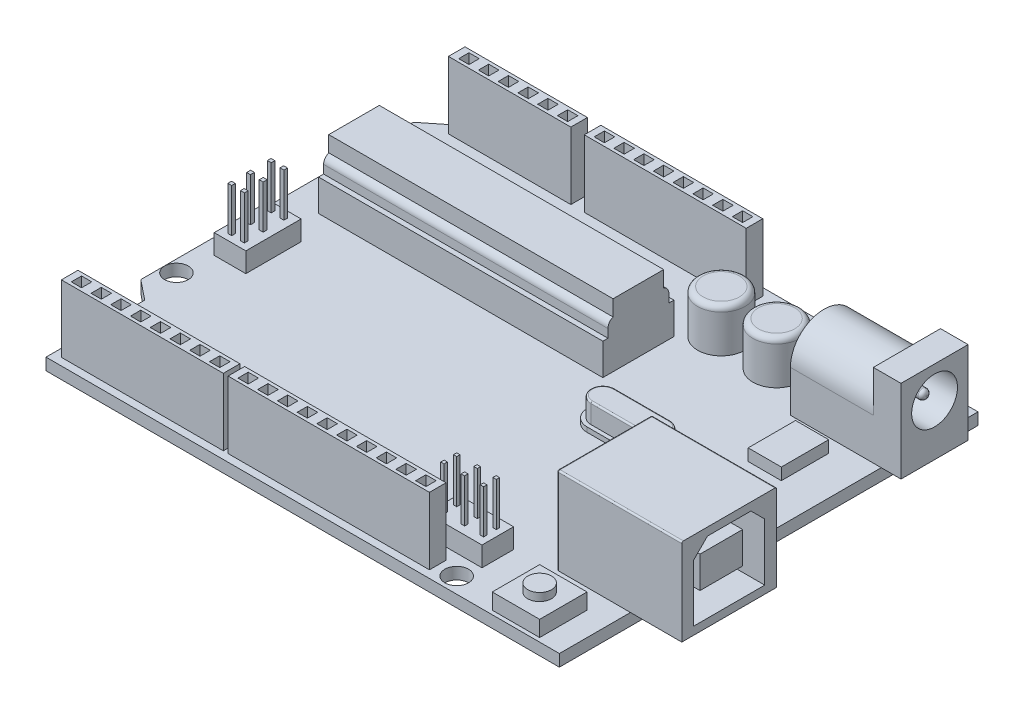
SolidWorks part; units mm, degrees
ref_plane "Alzado" through (0, 0, 0) normal (0, 0, 1) x (1, 0, 0)
ref_plane "Planta" through (0, 0, 0) normal (0, 1, 0) x (1, 0, 0)
ref_plane "Vista lateral" through (0, 0, 0) normal (1, 0, 0) x (0, 0, -1)
sketch "Croquis1" plane through (0, 0, 0) normal (0, 1, 0) x (1, 0, 0)
  line L0 (-32.5, -26.5) -> (-32.5, -14)
  line L1 (-32.5, 26.5) -> (32.5, 26.5)
  line L2 (-32.5, 26.5) -> (-32.5, -26.5) construction
  line L3 (-32.5, -26.5) -> (32.5, -26.5)
  line L4 (32.5, 26.5) -> (32.5, -26.5)
  line L5 (-32.5, 26.5) -> (32.5, -26.5) construction
  line L6 (-32.5, -26.5) -> (32.5, 26.5) construction
  line L7 (-32.5, 26.5) -> (-32.5, 24.5)
  line L8 (-32.5, 24.5) -> (-35, 22.5)
  line L9 (-35, 22.5) -> (-35, -12)
  line L10 (-35, -12) -> (-32.5, -14)
  point P0 (0, 0)
  dimension "D1" = 53
  dimension "D2" = 65
  dimension "D3" = 12.5
  dimension "D4" = 2
  dimension "D5" = 2.5
  dimension "D6" = 2
  dimension "D7" = 2
extrude "Saliente-Extruir1" add sketch "Croquis1" along normal blind 1.5
sketch "Croquis2" plane through (0, 1.5, 0) normal (0, 1, 0) x (1, 0, 0)
  line L0 (-35, 19) -> (34.4446, 19) construction
  line L1 (-35, 22.5) -> (-35, -12) construction
  line L2 (-37.4466, -9) -> (38.9629, -9) construction
  line L3 (-32.5, -26.5) -> (32.5, -26.5) construction
  line L4 (17.5, -22.2903) -> (17.5, -28.2143) construction
  line L5 (32.5, 26.5) -> (-32.5, 26.5) construction
  line L6 (-33.485, -11.6472) -> (-33.485, 23.7964) construction
  line L7 (-36.1413, -24.5) -> (34.4446, -24.5) construction
  line L8 (35.3482, 24.5) -> (-37.4466, 24.5) construction
  line L9 (32.5, -26.5) -> (32.5, 26.5) construction
  line L10 (18.5, 27.8126) -> (18.5, 22.4911) construction
  circle A0 centre (-33.485, 19) radius 1.5
  circle A1 centre (-33.485, -9) radius 1.5
  circle A2 centre (18.5, 24.5) radius 1.5
  circle A3 centre (17.5, -24.5) radius 1.5
  dimension "D4" = 3
  dimension "D5" = 3
  dimension "D10" = 3
  dimension "D11" = 3
  dimension "D1" = 17.5
  dimension "D2" = 7.5
  dimension "D3" = 1.515
  dimension "D6" = 2
  dimension "D7" = 2
  dimension "D8" = 15
  dimension "D9" = 14
extrude "Cortar-Extruir1" cut sketch "Croquis2" against normal through all
sketch "Croquis3" plane through (0, 0, 0) normal (0, -1, 0) x (1, 0, 0)
  line L0 (36.9547, -17.5) -> (-44.9771, -17.5) construction
  line L2 (32.5, -26.5) -> (-32.5, -26.5) construction
  line L3 (27, 28.4151) -> (27, -28.2143) construction
  line L4 (32.5, 26.5) -> (32.5, -26.5) construction
  line L5 (21, 23.2943) -> (21, -22.4911) construction
  line L6 (24.0023, -15.2618) -> (24.0023, -31.2265) construction
  line L7 (19.3836, -23.5) -> (29.123, -23.5) construction
  ellipse E0 centre (27, -17.5) end of major axis (27, -16.5) minor radius 0.15
  ellipse E1 centre (21, -17.5) end of major axis (21, -16.5) minor radius 0.15
  ellipse E2 centre (24.0023, -23.5) end of major axis (25.0023, -23.5) minor radius 0.15
  dimension "D1" = 9
  dimension "D2" = 5.5
  dimension "D3" = 6
  dimension "D4" = 3
  dimension "D5" = 0.3
  dimension "D6" = 2
  dimension "D7" = 0.3
  dimension "D8" = 2
  dimension "D9" = 0.3
  dimension "D10" = 2
extrude "Saliente-Extruir2" add sketch "Croquis3" along normal blind 2.8
fillet "Redondeo1" radius 1 1 edges at (27, 0, -16.5)
fillet "Redondeo2" radius 1 2 edges at (25.0023, 0, -23.5) (21, 0, -16.5)
fillet "Redondeo3" radius 0.1 3 edges at (21, -2.8, -16.5) (25.0023, -2.8, -23.5) (27, -2.8, -16.5)
sketch "Croquis4" plane through (0, 1.5, 0) normal (0, 1, 0) x (1, 0, 0)
  line L0 (32.5, -26.5) -> (32.5, 26.5) construction
  line L1 (23.5, -20) -> (29.5, -20)
  line L2 (23.5, -20) -> (23.5, -26)
  line L3 (23.5, -26) -> (29.5, -26)
  line L4 (29.5, -20) -> (29.5, -26)
  line L5 (23.5, -20) -> (29.5, -26) construction
  line L6 (23.5, -26) -> (29.5, -20) construction
  line L7 (-32.5, -26.5) -> (32.5, -26.5) construction
  point P0 (26.5, -23)
  dimension "D1" = 6
  dimension "D2" = 6
  dimension "D3" = 3
  dimension "D4" = 0.5
extrude "Saliente-Extruir3" add sketch "Croquis4" along normal blind 2
sketch "Croquis5" plane through (0, 3.5, 0) normal (0, 1, 0) x (1, 0, 0)
  circle A0 centre (26.5, -23) radius 1.5
  dimension "D1" = 3
extrude "Saliente-Extruir4" add sketch "Croquis5" along normal blind 1
sketch "Croquis6" plane through (0, 1.5, 0) normal (0, 1, 0) x (1, 0, 0)
  line L0 (10, 1.5) -> (17, 1.5) construction
  line L1 (10, 3.5) -> (17, 3.5)
  line L2 (10, -0.5) -> (17, -0.5)
  line L3 (8, 1.5) -> (8, 12.5737) construction
  line L4 (19, 1.5) -> (19, 12.5737) construction
  line L5 (32.5, 26.5) -> (-32.5, 26.5) construction
  line L7 (32.5, -26.5) -> (32.5, 26.5) construction
  arc A0 (10, 3.5) -> (10, -0.5) centre (10, 1.5) ccw
  arc A1 (17, -0.5) -> (17, 3.5) centre (17, 1.5) ccw
  point P2 (13.5, 1.5)
  dimension "D2" = 11
  dimension "D1" = 7
  dimension "D3" = 25
  dimension "D4" = 19
extrude "Saliente-Extruir5" add sketch "Croquis6" along normal blind 0.6
sketch "Croquis7" plane through (0, 2.1, 0) normal (0, 1, 0) x (1, 0, 0)
  line L0 (10, 1.5) -> (17, 1.5) construction
  line L1 (10, 3) -> (17, 3)
  line L2 (10, 0) -> (17, 0)
  arc A0 (10, 3) -> (10, 0) centre (10, 1.5) ccw
  arc A1 (17, 0) -> (17, 3) centre (17, 1.5) ccw
  point P4 (13.5, 1.5)
extrude "Saliente-Extruir6" add sketch "Croquis7" along normal blind 2.5
fillet "Redondeo4" radius 0.2 4 edges at (13.5, 4.6, -3) (18.5, 4.6, -1.5) (13.5, 4.6, 0) (8.5, 4.6, -1.5)
sketch "Croquis8" plane through (0, 1.5, 0) normal (0, 1, 0) x (1, 0, 0)
  line L0 (32.5, -26.5) -> (32.5, 26.5) construction
  line L1 (23.2, -5.5) -> (39, -5.5)
  line L2 (23.2, -5.5) -> (23.2, -17.5)
  line L3 (23.2, -17.5) -> (39, -17.5)
  line L4 (39, -5.5) -> (39, -17.5)
  line L5 (23.2, -5.5) -> (39, -17.5) construction
  line L6 (23.2, -17.5) -> (39, -5.5) construction
  line L7 (-32.5, -26.5) -> (32.5, -26.5) construction
  point P0 (31.1, -11.5)
  dimension "D1" = 6.5
  dimension "D2" = 15.8
  dimension "D3" = 12
  dimension "D4" = 9
extrude "Saliente-Extruir7" add sketch "Croquis8" along normal blind 11
fillet "Redondeo5" radius 0.2 5 edges at (23.2, 7, 5.5) (23.2, 7, 17.5) (23.2, 12.5, 11.5) (31.1, 12.5, 5.5) (31.1, 12.5, 17.5)
sketch "Croquis9" plane through (0, 1.5, 0) normal (0, 1, 0) x (1, 0, 0)
  line L0 (32.5, 26.5) -> (-32.5, 26.5) construction
  line L1 (21, 22.75) -> (35, 22.75)
  line L2 (21, 22.75) -> (21, 14.25)
  line L3 (21, 14.25) -> (35, 14.25)
  line L4 (35, 22.75) -> (35, 14.25)
  line L5 (21, 22.75) -> (35, 14.25) construction
  line L6 (21, 14.25) -> (35, 22.75) construction
  line L7 (32.5, -5.5) -> (32.5, 26.5) construction
  point P0 (28, 18.5)
  dimension "D1" = 8
  dimension "D2" = 14
  dimension "D3" = 2.5
  dimension "D4" = 8.5
extrude "Saliente-Extruir8" add sketch "Croquis9" along normal blind 10.5
sketch "Croquis10" plane through (21, 0, 0) normal (-1, 0, 0) x (0, 0, 1)
  line L0 (-22.75, 6.75) -> (-14.25, 6.75) construction
  line L1 (-22.75, 12) -> (-22.75, 1.5) construction
  line L2 (-14.25, 12) -> (-14.25, 1.5) construction
  line L3 (-22.75, 6.75) -> (-24.8341, 6.75)
  line L4 (-24.8341, 6.75) -> (-24.8341, 13.7085)
  line L5 (-24.8341, 13.7085) -> (-12.9417, 13.7085)
  line L6 (-12.9417, 13.7085) -> (-12.9417, 6.75)
  line L7 (-12.9417, 6.75) -> (-14.25, 6.75)
  arc A0 (-22.75, 6.75) -> (-14.25, 6.75) centre (-18.5, 6.75) cw
extrude "Cortar-Extruir2" cut sketch "Croquis10" against normal blind 10.5
sketch "Croquis11" plane through (0, 1.5, 0) normal (0, 1, 0) x (1, 0, 0)
  line L0 (-35, 22.5) -> (-35, -12) construction
  line L1 (-31, 15.5) -> (5, 15.5)
  line L2 (-31, 15.5) -> (-31, 6.5)
  line L3 (-31, 6.5) -> (5, 6.5)
  line L4 (5, 15.5) -> (5, 6.5)
  line L5 (-31, 15.5) -> (5, 6.5) construction
  line L6 (-31, 6.5) -> (5, 15.5) construction
  line L7 (32.5, 26.5) -> (-32.5, 26.5) construction
  point P0 (-13, 11)
  dimension "D1" = 36
  dimension "D2" = 9
  dimension "D3" = 4
  dimension "D4" = 11
extrude "Saliente-Extruir9" add sketch "Croquis11" along normal blind 4
sketch "Croquis12" plane through (0, 5.5, 0) normal (0, 1, 0) x (1, 0, 0)
  line L0 (-31, 11) -> (5, 11) construction
  line L1 (-31, 15.5) -> (-31, 6.5) construction
  line L2 (5, 6.5) -> (5, 15.5) construction
  line L4 (-31, 14.8545) -> (5, 14.8545)
  line L5 (-31, 14.8545) -> (-31, 7.1455)
  line L6 (-31, 7.1455) -> (5, 7.1455)
  line L7 (5, 14.8545) -> (5, 7.1455)
  line L8 (-31, 14.8545) -> (5, 7.1455) construction
  line L9 (-31, 7.1455) -> (5, 14.8545) construction
  point P6 (-13, 11)
extrude "Saliente-Extruir10" add sketch "Croquis12" along normal blind 2
sketch "Croquis13" plane through (0, 7.5, 0) normal (0, 1, 0) x (1, 0, 0)
  line L0 (-31, 11) -> (5, 11) construction
  line L1 (-31, 14.8545) -> (-31, 7.1455) construction
  line L2 (5, 7.1455) -> (5, 14.8545) construction
  line L4 (-31, 14.2021) -> (5, 14.2021)
  line L5 (-31, 14.2021) -> (-31, 7.7979)
  line L6 (-31, 7.7979) -> (5, 7.7979)
  line L7 (5, 14.2021) -> (5, 7.7979)
  line L8 (-31, 14.2021) -> (5, 7.7979) construction
  line L9 (-31, 7.7979) -> (5, 14.2021) construction
  point P6 (-13, 11)
extrude "Saliente-Extruir11" add sketch "Croquis13" along normal blind 2
fillet "Redondeo6" radius 1 2 edges at (-13, 7.5, -14.8545) (-13, 7.5, -7.1455)
sketch "Croquis15" plane through (0, 1.5, 0) normal (0, 1, 0) x (1, 0, 0)
  line L0 (32.5, -5.5) -> (32.5, 14.25) construction
  line L1 (32.5, 26.5) -> (-32.5, 26.5) construction
  circle A0 centre (15, 18.5) radius 3
  circle A1 centre (8, 18.5) radius 3
  dimension "D1" = 17.5
  dimension "D3" = 6
  dimension "D4" = 6
  dimension "D2" = 8
  dimension "D5" = 7
extrude "Saliente-Extruir12" add sketch "Croquis15" along normal blind 5.5
fillet "Redondeo7" radius 0.7 2 edges at (15, 7, -15.5) (8, 7, -15.5)
sketch "Croquis16" plane through (0, 1.5, 0) normal (0, 1, 0) x (1, 0, 0)
  line L0 (11.2, -18) -> (18.2, -18)
  line L1 (-33, 2.3) -> (-29, 2.3)
  line L2 (-33, 2.3) -> (-33, -4.7)
  line L3 (-33, -4.7) -> (-29, -4.7)
  line L4 (-29, 2.3) -> (-29, -4.7)
  line L5 (-33, 2.3) -> (-29, -4.7) construction
  line L6 (-33, -4.7) -> (-29, 2.3) construction
  line L7 (11.2, -18) -> (11.2, -22)
  line L8 (11.2, -22) -> (18.2, -22)
  line L9 (18.2, -18) -> (18.2, -22)
  line L10 (11.2, -18) -> (18.2, -22) construction
  line L11 (11.2, -22) -> (18.2, -18) construction
  line L12 (32.5, 26.5) -> (-32.5, 26.5) construction
  line L13 (-35, 22.5) -> (-35, -12) construction
  line L14 (32.5, -26.5) -> (32.5, -17.5) construction
  line L16 (-32.5, -26.5) -> (32.5, -26.5) construction
  point P0 (-31, -1.2)
  point P5 (14.7, -20)
  dimension "D1" = 24.2
  dimension "D2" = 4
  dimension "D3" = 7
  dimension "D4" = 4
  dimension "D5" = 4
  dimension "D6" = 7
  dimension "D7" = 14.3
  dimension "D8" = 4.5
extrude "Saliente-Extruir13" add sketch "Croquis16" along normal blind 2.5
sketch "Croquis17" plane through (0, 4, 0) normal (0, 1, 0) x (1, 0, 0)
  line L0 (-31.8, 2.3) -> (-31.8, -4.7) construction
  line L1 (-29, 2.3) -> (-33, 2.3) construction
  line L2 (-33, -4.7) -> (-29, -4.7) construction
  line L3 (-30.2, 2.3) -> (-30.2, -4.7) construction
  line L4 (-29, 2.3) -> (-33, 2.3) construction
  line L5 (-33, -4.7) -> (-29, -4.7) construction
  line L6 (-33, 2.3) -> (-33, -4.7) construction
  line L7 (-29, -4.7) -> (-29, 2.3) construction
  line L8 (-33, 1.3) -> (-29, 1.3) construction
  line L9 (-33, -1.3) -> (-29, -1.3) construction
  line L10 (-33, 2.3) -> (-33, -4.7) construction
  line L11 (-29, -4.7) -> (-29, 2.3) construction
  line L12 (-33, -3.7) -> (-29, -3.7) construction
  line L13 (11.2, -19.2) -> (18.2, -19.2) construction
  line L14 (11.2, -18) -> (11.2, -22) construction
  line L15 (18.2, -22) -> (18.2, -18) construction
  line L16 (11.2, -20.8) -> (18.2, -20.8) construction
  line L17 (18.2, -18) -> (11.2, -18) construction
  line L18 (11.2, -22) -> (18.2, -22) construction
  line L19 (12.2, -18) -> (12.2, -22) construction
  line L20 (11.2, -22) -> (18.2, -22) construction
  line L21 (14.8, -18) -> (14.8, -22) construction
  line L22 (17.2, -18) -> (17.2, -22) construction
  line L23 (18.2, -18) -> (11.2, -18) construction
  line L25 (-32.0421, 1.5304) -> (-31.5579, 1.5304)
  line L26 (-32.0421, 1.5304) -> (-32.0421, 1.0696)
  line L27 (-32.0421, 1.0696) -> (-31.5579, 1.0696)
  line L28 (-31.5579, 1.5304) -> (-31.5579, 1.0696)
  line L29 (-32.0421, 1.5304) -> (-31.5579, 1.0696) construction
  line L30 (-32.0421, 1.0696) -> (-31.5579, 1.5304) construction
  line L31 (-30.4481, 1.5304) -> (-29.9519, 1.5304)
  line L32 (-30.4481, 1.5304) -> (-30.4481, 1.0696)
  line L33 (-30.4481, 1.0696) -> (-29.9519, 1.0696)
  line L34 (-29.9519, 1.5304) -> (-29.9519, 1.0696)
  line L35 (-30.4481, 1.5304) -> (-29.9519, 1.0696) construction
  line L36 (-30.4481, 1.0696) -> (-29.9519, 1.5304) construction
  line L37 (-32.0421, -1.0471) -> (-31.5579, -1.0471)
  line L38 (-32.0421, -1.0471) -> (-32.0421, -1.5529)
  line L39 (-32.0421, -1.5529) -> (-31.5579, -1.5529)
  line L40 (-31.5579, -1.0471) -> (-31.5579, -1.5529)
  line L41 (-32.0421, -1.0471) -> (-31.5579, -1.5529) construction
  line L42 (-32.0421, -1.5529) -> (-31.5579, -1.0471) construction
  line L43 (-30.4481, -1.0471) -> (-29.9519, -1.0471)
  line L44 (-30.4481, -1.0471) -> (-30.4481, -1.5529)
  line L45 (-30.4481, -1.5529) -> (-29.9519, -1.5529)
  line L46 (-29.9519, -1.0471) -> (-29.9519, -1.5529)
  line L47 (-30.4481, -1.0471) -> (-29.9519, -1.5529) construction
  line L48 (-30.4481, -1.5529) -> (-29.9519, -1.0471) construction
  line L49 (-32.0421, -3.4686) -> (-31.5579, -3.4686)
  line L50 (-32.0421, -3.4686) -> (-32.0421, -3.9314)
  line L51 (-32.0421, -3.9314) -> (-31.5579, -3.9314)
  line L52 (-31.5579, -3.4686) -> (-31.5579, -3.9314)
  line L53 (-32.0421, -3.4686) -> (-31.5579, -3.9314) construction
  line L54 (-32.0421, -3.9314) -> (-31.5579, -3.4686) construction
  line L55 (-30.4481, -3.4686) -> (-29.9519, -3.4686)
  line L56 (-30.4481, -3.4686) -> (-30.4481, -3.9314)
  line L57 (-30.4481, -3.9314) -> (-29.9519, -3.9314)
  line L58 (-29.9519, -3.4686) -> (-29.9519, -3.9314)
  line L59 (-30.4481, -3.4686) -> (-29.9519, -3.9314) construction
  line L60 (-30.4481, -3.9314) -> (-29.9519, -3.4686) construction
  line L61 (11.9899, -18.9946) -> (12.4101, -18.9946)
  line L62 (11.9899, -18.9946) -> (11.9899, -19.4054)
  line L63 (11.9899, -19.4054) -> (12.4101, -19.4054)
  line L64 (12.4101, -18.9946) -> (12.4101, -19.4054)
  line L65 (11.9899, -18.9946) -> (12.4101, -19.4054) construction
  line L66 (11.9899, -19.4054) -> (12.4101, -18.9946) construction
  line L67 (14.5761, -18.9946) -> (15.0239, -18.9946)
  line L68 (14.5761, -18.9946) -> (14.5761, -19.4054)
  line L69 (14.5761, -19.4054) -> (15.0239, -19.4054)
  line L70 (15.0239, -18.9946) -> (15.0239, -19.4054)
  line L71 (14.5761, -18.9946) -> (15.0239, -19.4054) construction
  line L72 (14.5761, -19.4054) -> (15.0239, -18.9946) construction
  line L73 (16.9801, -18.9946) -> (17.4199, -18.9946)
  line L74 (16.9801, -18.9946) -> (16.9801, -19.4054)
  line L75 (16.9801, -19.4054) -> (17.4199, -19.4054)
  line L76 (17.4199, -18.9946) -> (17.4199, -19.4054)
  line L77 (16.9801, -18.9946) -> (17.4199, -19.4054) construction
  line L78 (16.9801, -19.4054) -> (17.4199, -18.9946) construction
  line L79 (11.9899, -20.5827) -> (12.4101, -20.5827)
  line L80 (11.9899, -20.5827) -> (11.9899, -21.0173)
  line L81 (11.9899, -21.0173) -> (12.4101, -21.0173)
  line L82 (12.4101, -20.5827) -> (12.4101, -21.0173)
  line L83 (11.9899, -20.5827) -> (12.4101, -21.0173) construction
  line L84 (11.9899, -21.0173) -> (12.4101, -20.5827) construction
  line L85 (14.5761, -20.5827) -> (15.0239, -20.5827)
  line L86 (14.5761, -20.5827) -> (14.5761, -21.0173)
  line L87 (14.5761, -21.0173) -> (15.0239, -21.0173)
  line L88 (15.0239, -20.5827) -> (15.0239, -21.0173)
  line L89 (14.5761, -20.5827) -> (15.0239, -21.0173) construction
  line L90 (14.5761, -21.0173) -> (15.0239, -20.5827) construction
  line L91 (16.9801, -20.5827) -> (17.4199, -20.5827)
  line L92 (16.9801, -20.5827) -> (16.9801, -21.0173)
  line L93 (16.9801, -21.0173) -> (17.4199, -21.0173)
  line L94 (17.4199, -20.5827) -> (17.4199, -21.0173)
  line L95 (16.9801, -20.5827) -> (17.4199, -21.0173) construction
  line L96 (16.9801, -21.0173) -> (17.4199, -20.5827) construction
  point P48 (-31.8, 1.3)
  point P53 (-30.2, 1.3)
  point P58 (-31.8, -1.3)
  point P63 (-30.2, -1.3)
  point P68 (-31.8, -3.7)
  point P73 (-30.2, -3.7)
  point P78 (12.2, -19.2)
  point P83 (14.8, -19.2)
  point P88 (17.2, -19.2)
  point P93 (12.2, -20.8)
  point P98 (14.8, -20.8)
  point P103 (17.2, -20.8)
  dimension "D1" = 1.2
  dimension "D2" = 1
  dimension "D3" = 1.2
  dimension "D4" = 1
  dimension "D5" = 2.6
  dimension "D6" = 1.2
  dimension "D7" = 1.2
  dimension "D8" = 1
  dimension "D9" = 1
  dimension "D10" = 2.6
extrude "Saliente-Extruir14" add sketch "Croquis17" along normal blind 5.5
sketch "Croquis18" plane through (0, 1.5, 0) normal (0, 1, 0) x (1, 0, 0)
  line L0 (32.5, 26.5) -> (-32.5, 26.5) construction
  line L1 (-31.5, -25.55) -> (-11, -25.55)
  line L2 (-31.5, -25.55) -> (-31.5, -23.45)
  line L3 (-31.5, -23.45) -> (-11, -23.45)
  line L4 (-11, -25.55) -> (-11, -23.45)
  line L5 (-31.5, -25.55) -> (-11, -23.45) construction
  line L6 (-31.5, -23.45) -> (-11, -25.55) construction
  line L7 (-10.4, -25.55) -> (15.1, -25.55)
  line L8 (-10.4, -25.55) -> (-10.4, -23.45)
  line L9 (-10.4, -23.45) -> (15.1, -23.45)
  line L10 (15.1, -25.55) -> (15.1, -23.45)
  line L11 (-10.4, -25.55) -> (15.1, -23.45) construction
  line L12 (-10.4, -23.45) -> (15.1, -25.55) construction
  line L13 (-31.5, 25.55) -> (-16, 25.55)
  line L14 (-31.5, 25.55) -> (-31.5, 23.45)
  line L15 (-31.5, 23.45) -> (-16, 23.45)
  line L16 (-16, 25.55) -> (-16, 23.45)
  line L17 (-31.5, 25.55) -> (-16, 23.45) construction
  line L18 (-31.5, 23.45) -> (-16, 25.55) construction
  line L19 (-14.3, 25.55) -> (6.2, 25.55)
  line L20 (-14.3, 25.55) -> (-14.3, 23.45)
  line L21 (-14.3, 23.45) -> (6.2, 23.45)
  line L22 (6.2, 25.55) -> (6.2, 23.45)
  line L23 (-14.3, 25.55) -> (6.2, 23.45) construction
  line L24 (-14.3, 23.45) -> (6.2, 25.55) construction
  line L25 (-32.5, -26.5) -> (32.5, -26.5) construction
  line L26 (-32.5, -14) -> (-32.5, -26.5) construction
  point P4 (-21.25, -24.5)
  point P9 (2.35, -24.5)
  point P14 (-23.75, 24.5)
  point P19 (-4.05, 24.5)
  dimension "D1" = 2.1
  dimension "D2" = 2.1
  dimension "D3" = 2.1
  dimension "D4" = 2.1
  dimension "D5" = 15.5
  dimension "D6" = 20.5
  dimension "D7" = 20.5
  dimension "D8" = 25.5
  dimension "D9" = 2
  dimension "D10" = 2
  dimension "D11" = 2
  dimension "D12" = 2
  dimension "D13" = 1
  dimension "D14" = 0.6
  dimension "D15" = 1
  dimension "D16" = 1.7
extrude "Saliente-Extruir15" add sketch "Croquis18" along normal blind 8.5
sketch "Croquis19" plane through (0, 10, 0) normal (0, 1, 0) x (1, 0, 0)
  line L0 (-31.5, 24.5) -> (6.2, 24.5) construction
  line L1 (-31.5, 25.55) -> (-31.5, 23.45) construction
  line L2 (6.2, 23.45) -> (6.2, 25.55) construction
  line L3 (-29.95, 25.55) -> (-29.95, 23.45) construction
  line L4 (-16, 25.55) -> (-31.5, 25.55) construction
  line L5 (-31.5, 23.45) -> (-16, 23.45) construction
  line L6 (-27.45, 25.55) -> (-27.45, 23.45) construction
  line L7 (-31.5, 23.45) -> (-16, 23.45) construction
  line L8 (-24.95, 25.55) -> (-24.95, 23.45) construction
  line L9 (-22.45, 25.55) -> (-22.45, 23.45) construction
  line L10 (-16, 25.55) -> (-31.5, 25.55) construction
  line L11 (-19.95, 25.55) -> (-19.95, 23.45) construction
  line L12 (-17.45, 25.55) -> (-17.45, 23.45) construction
  line L13 (-12.8, 25.55) -> (-12.8, 23.45) construction
  line L14 (6.2, 25.55) -> (-14.3, 25.55) construction
  line L15 (-14.3, 23.45) -> (6.2, 23.45) construction
  line L16 (-10.3, 25.55) -> (-10.3, 23.45) construction
  line L17 (-14.3, 23.45) -> (6.2, 23.45) construction
  line L18 (-7.8, 25.55) -> (-7.8, 23.45) construction
  line L19 (-5.3, 25.55) -> (-5.3, 23.45) construction
  line L20 (-2.8, 25.55) -> (-2.8, 23.45) construction
  line L21 (-0.3, 25.55) -> (-0.3, 23.45) construction
  line L22 (6.2, 25.55) -> (-14.3, 25.55) construction
  line L23 (2.2, 25.55) -> (2.2, 23.45) construction
  line L24 (4.7, 25.55) -> (4.7, 23.45) construction
  line L25 (-31.5, -24.5) -> (15.1, -24.5) construction
  line L26 (-31.5, -23.45) -> (-31.5, -25.55) construction
  line L27 (15.1, -25.55) -> (15.1, -23.45) construction
  line L28 (-30, -23.45) -> (-30, -25.55) construction
  line L29 (-11, -23.45) -> (-31.5, -23.45) construction
  line L30 (-31.5, -25.55) -> (-11, -25.55) construction
  line L31 (-27.5, -23.45) -> (-27.5, -25.55) construction
  line L32 (-25, -23.45) -> (-25, -25.55) construction
  line L33 (-11, -23.45) -> (-31.5, -23.45) construction
  line L34 (-31.5, -25.55) -> (-11, -25.55) construction
  line L35 (-22.5, -23.45) -> (-22.5, -25.55) construction
  line L36 (-20, -23.45) -> (-20, -25.55) construction
  line L37 (-17.5, -23.45) -> (-17.5, -25.55) construction
  line L38 (-15, -23.45) -> (-15, -25.55) construction
  line L39 (-12.5, -23.45) -> (-12.5, -25.55) construction
  line L40 (-8.9, -23.45) -> (-8.9, -25.55) construction
  line L41 (15.1, -23.45) -> (-10.4, -23.45) construction
  line L42 (-10.4, -25.55) -> (15.1, -25.55) construction
  line L43 (-6.4, -23.45) -> (-6.4, -25.55) construction
  line L44 (15.1, -23.45) -> (-10.4, -23.45) construction
  line L45 (-3.9, -23.45) -> (-3.9, -25.55) construction
  line L46 (-1.4, -23.45) -> (-1.4, -25.55) construction
  line L47 (1.1, -23.45) -> (1.1, -25.55) construction
  line L48 (3.6, -23.45) -> (3.6, -25.55) construction
  line L49 (6.1, -23.45) -> (6.1, -25.55) construction
  line L50 (8.6, -23.45) -> (8.6, -25.55) construction
  line L51 (11.1, -23.45) -> (11.1, -25.55) construction
  line L52 (13.6, -23.45) -> (13.6, -25.55) construction
  line L53 (-7.05, -23.85) -> (-5.75, -23.85)
  line L54 (-31.5, 25.55) -> (-31.5, 23.45) construction
  line L55 (-14.3, 25.55) -> (-14.3, 23.45) construction
  line L56 (-10.4, -23.45) -> (-10.4, -25.55) construction
  line L57 (-7.05, -23.85) -> (-7.05, -25.15)
  line L58 (-7.05, -25.15) -> (-5.75, -25.15)
  line L59 (-9.55, -23.85) -> (-8.25, -23.85)
  line L60 (-9.55, -23.85) -> (-9.55, -25.15)
  line L61 (-9.55, -25.15) -> (-8.25, -25.15)
  line L62 (-8.25, -23.85) -> (-8.25, -25.15)
  line L63 (-9.55, -23.85) -> (-8.25, -25.15) construction
  line L64 (-9.55, -25.15) -> (-8.25, -23.85) construction
  line L65 (-5.75, -23.85) -> (-5.75, -25.15)
  line L66 (-29, -24.5) -> (17.6, -24.5) construction
  line L67 (-6.4, -23.45) -> (-6.4, -25.55) construction
  line L68 (-7.05, -23.85) -> (-5.75, -25.15) construction
  line L69 (-7.05, -25.15) -> (-5.75, -23.85) construction
  line L70 (-4.55, -23.85) -> (-3.25, -23.85)
  line L71 (-4.55, -23.85) -> (-4.55, -25.15)
  line L72 (-4.55, -25.15) -> (-3.25, -25.15)
  line L73 (-3.25, -23.85) -> (-3.25, -25.15)
  line L74 (-26.5, -24.5) -> (20.1, -24.5) construction
  line L75 (-3.9, -23.45) -> (-3.9, -25.55) construction
  line L76 (-4.55, -23.85) -> (-3.25, -25.15) construction
  line L77 (-4.55, -25.15) -> (-3.25, -23.85) construction
  line L78 (-2.05, -23.85) -> (-0.75, -23.85)
  line L79 (-2.05, -23.85) -> (-2.05, -25.15)
  line L80 (-2.05, -25.15) -> (-0.75, -25.15)
  line L81 (-0.75, -23.85) -> (-0.75, -25.15)
  line L82 (-24, -24.5) -> (22.6, -24.5) construction
  line L83 (-1.4, -23.45) -> (-1.4, -25.55) construction
  line L84 (-2.05, -23.85) -> (-0.75, -25.15) construction
  line L85 (-2.05, -25.15) -> (-0.75, -23.85) construction
  line L86 (0.45, -23.85) -> (1.75, -23.85)
  line L87 (0.45, -23.85) -> (0.45, -25.15)
  line L88 (0.45, -25.15) -> (1.75, -25.15)
  line L89 (1.75, -23.85) -> (1.75, -25.15)
  line L90 (-21.5, -24.5) -> (25.1, -24.5) construction
  line L91 (1.1, -23.45) -> (1.1, -25.55) construction
  line L92 (0.45, -23.85) -> (1.75, -25.15) construction
  line L93 (0.45, -25.15) -> (1.75, -23.85) construction
  line L94 (2.95, -23.85) -> (4.25, -23.85)
  line L95 (2.95, -23.85) -> (2.95, -25.15)
  line L96 (2.95, -25.15) -> (4.25, -25.15)
  line L97 (4.25, -23.85) -> (4.25, -25.15)
  line L98 (-19, -24.5) -> (27.6, -24.5) construction
  line L99 (3.6, -23.45) -> (3.6, -25.55) construction
  line L100 (2.95, -23.85) -> (4.25, -25.15) construction
  line L101 (2.95, -25.15) -> (4.25, -23.85) construction
  line L102 (5.45, -23.85) -> (6.75, -23.85)
  line L103 (5.45, -23.85) -> (5.45, -25.15)
  line L104 (5.45, -25.15) -> (6.75, -25.15)
  line L105 (6.75, -23.85) -> (6.75, -25.15)
  line L106 (-16.5, -24.5) -> (30.1, -24.5) construction
  line L107 (6.1, -23.45) -> (6.1, -25.55) construction
  line L108 (5.45, -23.85) -> (6.75, -25.15) construction
  line L109 (5.45, -25.15) -> (6.75, -23.85) construction
  line L110 (7.95, -23.85) -> (9.25, -23.85)
  line L111 (7.95, -23.85) -> (7.95, -25.15)
  line L112 (7.95, -25.15) -> (9.25, -25.15)
  line L113 (9.25, -23.85) -> (9.25, -25.15)
  line L114 (-14, -24.5) -> (32.6, -24.5) construction
  line L115 (8.6, -23.45) -> (8.6, -25.55) construction
  line L116 (7.95, -23.85) -> (9.25, -25.15) construction
  line L117 (7.95, -25.15) -> (9.25, -23.85) construction
  line L118 (10.45, -23.85) -> (11.75, -23.85)
  line L119 (10.45, -23.85) -> (10.45, -25.15)
  line L120 (10.45, -25.15) -> (11.75, -25.15)
  line L121 (11.75, -23.85) -> (11.75, -25.15)
  line L122 (-11.5, -24.5) -> (35.1, -24.5) construction
  line L123 (11.1, -23.45) -> (11.1, -25.55) construction
  line L124 (10.45, -23.85) -> (11.75, -25.15) construction
  line L125 (10.45, -25.15) -> (11.75, -23.85) construction
  line L126 (12.95, -23.85) -> (14.25, -23.85)
  line L127 (12.95, -23.85) -> (12.95, -25.15)
  line L128 (12.95, -25.15) -> (14.25, -25.15)
  line L129 (14.25, -23.85) -> (14.25, -25.15)
  line L130 (-9, -24.5) -> (37.6, -24.5) construction
  line L131 (13.6, -23.45) -> (13.6, -25.55) construction
  line L132 (12.95, -23.85) -> (14.25, -25.15) construction
  line L133 (12.95, -25.15) -> (14.25, -23.85) construction
  line L134 (-28.15, -25.15) -> (-26.85, -25.15)
  line L135 (-30.65, -25.15) -> (-29.35, -25.15)
  line L136 (-30.65, -25.15) -> (-30.65, -23.85)
  line L137 (-30.65, -23.85) -> (-29.35, -23.85)
  line L138 (-29.35, -25.15) -> (-29.35, -23.85)
  line L139 (-30.65, -25.15) -> (-29.35, -23.85) construction
  line L140 (-30.65, -23.85) -> (-29.35, -25.15) construction
  line L141 (-28.15, -25.15) -> (-28.15, -23.85)
  line L142 (-28.15, -23.85) -> (-26.85, -23.85)
  line L143 (-26.85, -25.15) -> (-26.85, -23.85)
  line L144 (-27.5, -23.45) -> (-27.5, -25.55) construction
  line L145 (-26.5, -24.5) -> (20.1, -24.5) construction
  line L146 (-28.15, -25.15) -> (-26.85, -23.85) construction
  line L147 (-28.15, -23.85) -> (-26.85, -25.15) construction
  line L148 (-25.65, -25.15) -> (-24.35, -25.15)
  line L149 (-25.65, -25.15) -> (-25.65, -23.85)
  line L150 (-25.65, -23.85) -> (-24.35, -23.85)
  line L151 (-24.35, -25.15) -> (-24.35, -23.85)
  line L152 (-25, -23.45) -> (-25, -25.55) construction
  line L153 (-24, -24.5) -> (22.6, -24.5) construction
  line L154 (-25.65, -25.15) -> (-24.35, -23.85) construction
  line L155 (-25.65, -23.85) -> (-24.35, -25.15) construction
  line L156 (-23.15, -25.15) -> (-21.85, -25.15)
  line L157 (-23.15, -25.15) -> (-23.15, -23.85)
  line L158 (-23.15, -23.85) -> (-21.85, -23.85)
  line L159 (-21.85, -25.15) -> (-21.85, -23.85)
  line L160 (-22.5, -23.45) -> (-22.5, -25.55) construction
  line L161 (-21.5, -24.5) -> (25.1, -24.5) construction
  line L162 (-23.15, -25.15) -> (-21.85, -23.85) construction
  line L163 (-23.15, -23.85) -> (-21.85, -25.15) construction
  line L164 (-20.65, -25.15) -> (-19.35, -25.15)
  line L165 (-20.65, -25.15) -> (-20.65, -23.85)
  line L166 (-20.65, -23.85) -> (-19.35, -23.85)
  line L167 (-19.35, -25.15) -> (-19.35, -23.85)
  line L168 (-20, -23.45) -> (-20, -25.55) construction
  line L169 (-19, -24.5) -> (27.6, -24.5) construction
  line L170 (-20.65, -25.15) -> (-19.35, -23.85) construction
  line L171 (-20.65, -23.85) -> (-19.35, -25.15) construction
  line L172 (-18.15, -25.15) -> (-16.85, -25.15)
  line L173 (-18.15, -25.15) -> (-18.15, -23.85)
  line L174 (-18.15, -23.85) -> (-16.85, -23.85)
  line L175 (-16.85, -25.15) -> (-16.85, -23.85)
  line L176 (-17.5, -23.45) -> (-17.5, -25.55) construction
  line L177 (-16.5, -24.5) -> (30.1, -24.5) construction
  line L178 (-18.15, -25.15) -> (-16.85, -23.85) construction
  line L179 (-18.15, -23.85) -> (-16.85, -25.15) construction
  line L180 (-15.65, -25.15) -> (-14.35, -25.15)
  line L181 (-15.65, -25.15) -> (-15.65, -23.85)
  line L182 (-15.65, -23.85) -> (-14.35, -23.85)
  line L183 (-14.35, -25.15) -> (-14.35, -23.85)
  line L184 (-15, -23.45) -> (-15, -25.55) construction
  line L185 (-14, -24.5) -> (32.6, -24.5) construction
  line L186 (-15.65, -25.15) -> (-14.35, -23.85) construction
  line L187 (-15.65, -23.85) -> (-14.35, -25.15) construction
  line L188 (-13.15, -25.15) -> (-11.85, -25.15)
  line L189 (-13.15, -25.15) -> (-13.15, -23.85)
  line L190 (-13.15, -23.85) -> (-11.85, -23.85)
  line L191 (-11.85, -25.15) -> (-11.85, -23.85)
  line L192 (-12.5, -23.45) -> (-12.5, -25.55) construction
  line L193 (-11.5, -24.5) -> (35.1, -24.5) construction
  line L194 (-13.15, -25.15) -> (-11.85, -23.85) construction
  line L195 (-13.15, -23.85) -> (-11.85, -25.15) construction
  line L196 (-28.1, 25.15) -> (-26.8, 25.15)
  line L197 (-30.6, 25.15) -> (-29.3, 25.15)
  line L198 (-30.6, 25.15) -> (-30.6, 23.85)
  line L199 (-30.6, 23.85) -> (-29.3, 23.85)
  line L200 (-29.3, 25.15) -> (-29.3, 23.85)
  line L201 (-30.6, 25.15) -> (-29.3, 23.85) construction
  line L202 (-30.6, 23.85) -> (-29.3, 25.15) construction
  line L203 (-28.1, 25.15) -> (-28.1, 23.85)
  line L204 (-28.1, 23.85) -> (-26.8, 23.85)
  line L205 (-26.8, 25.15) -> (-26.8, 23.85)
  line L206 (-28.1, 25.15) -> (-26.8, 23.85) construction
  line L207 (-28.1, 23.85) -> (-26.8, 25.15) construction
  line L208 (-25.6, 25.15) -> (-24.3, 25.15)
  line L209 (-25.6, 25.15) -> (-25.6, 23.85)
  line L210 (-25.6, 23.85) -> (-24.3, 23.85)
  line L211 (-24.3, 25.15) -> (-24.3, 23.85)
  line L212 (-25.6, 25.15) -> (-24.3, 23.85) construction
  line L213 (-25.6, 23.85) -> (-24.3, 25.15) construction
  line L214 (-23.1, 25.15) -> (-21.8, 25.15)
  line L215 (-23.1, 25.15) -> (-23.1, 23.85)
  line L216 (-23.1, 23.85) -> (-21.8, 23.85)
  line L217 (-21.8, 25.15) -> (-21.8, 23.85)
  line L218 (-23.1, 25.15) -> (-21.8, 23.85) construction
  line L219 (-23.1, 23.85) -> (-21.8, 25.15) construction
  line L220 (-20.6, 25.15) -> (-19.3, 25.15)
  line L221 (-20.6, 25.15) -> (-20.6, 23.85)
  line L222 (-20.6, 23.85) -> (-19.3, 23.85)
  line L223 (-19.3, 25.15) -> (-19.3, 23.85)
  line L224 (-20.6, 25.15) -> (-19.3, 23.85) construction
  line L225 (-20.6, 23.85) -> (-19.3, 25.15) construction
  line L226 (-18.1, 25.15) -> (-16.8, 25.15)
  line L227 (-18.1, 25.15) -> (-18.1, 23.85)
  line L228 (-18.1, 23.85) -> (-16.8, 23.85)
  line L229 (-16.8, 25.15) -> (-16.8, 23.85)
  line L230 (-18.1, 25.15) -> (-16.8, 23.85) construction
  line L231 (-18.1, 23.85) -> (-16.8, 25.15) construction
  line L232 (-10.95, 25.15) -> (-9.65, 25.15)
  line L233 (-13.45, 25.15) -> (-12.15, 25.15)
  line L234 (-13.45, 25.15) -> (-13.45, 23.85)
  line L235 (-13.45, 23.85) -> (-12.15, 23.85)
  line L236 (-12.15, 25.15) -> (-12.15, 23.85)
  line L237 (-13.45, 25.15) -> (-12.15, 23.85) construction
  line L238 (-13.45, 23.85) -> (-12.15, 25.15) construction
  line L239 (-10.95, 25.15) -> (-10.95, 23.85)
  line L240 (-10.95, 23.85) -> (-9.65, 23.85)
  line L241 (-9.65, 25.15) -> (-9.65, 23.85)
  line L242 (-10.3, 25.55) -> (-10.3, 23.45) construction
  line L243 (-10.95, 25.15) -> (-9.65, 23.85) construction
  line L244 (-10.95, 23.85) -> (-9.65, 25.15) construction
  line L245 (-8.45, 25.15) -> (-7.15, 25.15)
  line L246 (-8.45, 25.15) -> (-8.45, 23.85)
  line L247 (-8.45, 23.85) -> (-7.15, 23.85)
  line L248 (-7.15, 25.15) -> (-7.15, 23.85)
  line L249 (-7.8, 25.55) -> (-7.8, 23.45) construction
  line L250 (-8.45, 25.15) -> (-7.15, 23.85) construction
  line L251 (-8.45, 23.85) -> (-7.15, 25.15) construction
  line L252 (-5.95, 25.15) -> (-4.65, 25.15)
  line L253 (-5.95, 25.15) -> (-5.95, 23.85)
  line L254 (-5.95, 23.85) -> (-4.65, 23.85)
  line L255 (-4.65, 25.15) -> (-4.65, 23.85)
  line L256 (-5.3, 25.55) -> (-5.3, 23.45) construction
  line L257 (-5.95, 25.15) -> (-4.65, 23.85) construction
  line L258 (-5.95, 23.85) -> (-4.65, 25.15) construction
  line L259 (-3.45, 25.15) -> (-2.15, 25.15)
  line L260 (-3.45, 25.15) -> (-3.45, 23.85)
  line L261 (-3.45, 23.85) -> (-2.15, 23.85)
  line L262 (-2.15, 25.15) -> (-2.15, 23.85)
  line L263 (-2.8, 25.55) -> (-2.8, 23.45) construction
  line L264 (-3.45, 25.15) -> (-2.15, 23.85) construction
  line L265 (-3.45, 23.85) -> (-2.15, 25.15) construction
  line L266 (-0.95, 25.15) -> (0.35, 25.15)
  line L267 (-0.95, 25.15) -> (-0.95, 23.85)
  line L268 (-0.95, 23.85) -> (0.35, 23.85)
  line L269 (0.35, 25.15) -> (0.35, 23.85)
  line L270 (-0.3, 25.55) -> (-0.3, 23.45) construction
  line L271 (-0.95, 25.15) -> (0.35, 23.85) construction
  line L272 (-0.95, 23.85) -> (0.35, 25.15) construction
  line L273 (1.55, 25.15) -> (2.85, 25.15)
  line L274 (1.55, 25.15) -> (1.55, 23.85)
  line L275 (1.55, 23.85) -> (2.85, 23.85)
  line L276 (2.85, 25.15) -> (2.85, 23.85)
  line L277 (2.2, 25.55) -> (2.2, 23.45) construction
  line L278 (1.55, 25.15) -> (2.85, 23.85) construction
  line L279 (1.55, 23.85) -> (2.85, 25.15) construction
  line L280 (4.05, 25.15) -> (5.35, 25.15)
  line L281 (4.05, 25.15) -> (4.05, 23.85)
  line L282 (4.05, 23.85) -> (5.35, 23.85)
  line L283 (5.35, 25.15) -> (5.35, 23.85)
  line L284 (4.7, 25.55) -> (4.7, 23.45) construction
  line L285 (4.05, 25.15) -> (5.35, 23.85) construction
  line L286 (4.05, 23.85) -> (5.35, 25.15) construction
  point P112 (-8.9, -24.5)
  point P117 (-30, -24.5)
  point P122 (-6.4, -24.5)
  point P131 (-3.9, -24.5)
  point P140 (-1.4, -24.5)
  point P149 (1.1, -24.5)
  point P158 (3.6, -24.5)
  point P167 (6.1, -24.5)
  point P176 (8.6, -24.5)
  point P185 (11.1, -24.5)
  point P194 (13.6, -24.5)
  point P203 (-29.95, 24.5)
  point P206 (-27.5, -24.5)
  point P215 (-25, -24.5)
  point P224 (-22.5, -24.5)
  point P233 (-20, -24.5)
  point P242 (-17.5, -24.5)
  point P251 (-15, -24.5)
  point P260 (-12.5, -24.5)
  point P271 (-12.8, 24.5)
  point P272 (-27.45, 24.5)
  point P277 (-24.95, 24.5)
  point P282 (-22.45, 24.5)
  point P287 (-19.95, 24.5)
  point P292 (-17.45, 24.5)
  point P304 (-10.3, 24.5)
  point P311 (-7.8, 24.5)
  point P318 (-5.3, 24.5)
  point P325 (-2.8, 24.5)
  point P332 (-0.3, 24.5)
  point P339 (2.2, 24.5)
  point P346 (4.7, 24.5)
  dimension "D1" = 2.5
  dimension "D2" = 2.5
  dimension "D3" = 2.5
  dimension "D4" = 2.5
  dimension "D5" = 2.5
  dimension "D6" = 1.55
  dimension "D7" = 1.5
  dimension "D8" = 2.5
  dimension "D9" = 2.5
  dimension "D10" = 2.5
  dimension "D11" = 2.5
  dimension "D12" = 2.5
  dimension "D13" = 2.5
  dimension "D14" = 2.5
  dimension "D15" = 1.5
  dimension "D16" = 2.5
  dimension "D17" = 2.5
  dimension "D18" = 2.5
  dimension "D19" = 2.5
  dimension "D20" = 2.5
  dimension "D21" = 2.5
  dimension "D22" = 2.5
  dimension "D23" = 1.5
  dimension "D24" = 2.5
  dimension "D25" = 2.5
  dimension "D26" = 2.5
  dimension "D27" = 2.5
  dimension "D28" = 2.5
  dimension "D29" = 2.5
  dimension "D30" = 2.5
  dimension "D31" = 2.5
  dimension "D32" = 2.5
  dimension "D33" = 1.3
  dimension "D34" = 1.3
  dimension "D36" = 1.3
  dimension "D37" = 1.3
  dimension "D39" = 1.3
  dimension "D40" = 1.3
  dimension "D42" = 8
  dimension "D35" = 10
  dimension "D38" = 8
  dimension "D41" = 6
extrude "Cortar-Extruir4" cut sketch "Croquis19" against normal blind 6
sketch "Croquis20" plane through (35, 0, 0) normal (1, 0, 0) x (0, 0, -1)
  line L0 (18.5, 1.5) -> (18.5, 8) construction
  line L1 (14.25, 1.5) -> (22.75, 1.5) construction
  circle A0 centre (18.5, 8) radius 2.9
  dimension "D2" = 5.8
  dimension "D1" = 6.5
extrude "Cortar-Extruir5" cut sketch "Croquis20" against normal blind 12
sketch "Croquis21" plane through (23, 0, 0) normal (1, 0, 0) x (0, 0, -1)
  circle A0 centre (18.5, 8) radius 0.6
  dimension "D1" = 1.2
extrude "Saliente-Extruir16" add sketch "Croquis21" along normal blind 11
fillet "Redondeo8" radius 0.5 1 edges at (34, 8, -19.1)
sketch "Croquis22" plane through (39, 0, 0) normal (1, 0, 0) x (0, 0, -1)
  line L0 (-17.5, 12.3) -> (-17.5, 1.5) construction
  line L1 (-16, 2.5) -> (-7, 2.5)
  line L2 (-16, 2.5) -> (-16, 9.75)
  line L3 (-16, 11.5) -> (-7, 11.5) construction
  line L4 (-7, 2.5) -> (-7, 9.75)
  line L5 (-16, 2.5) -> (-7, 11.5) construction
  line L6 (-16, 11.5) -> (-7, 2.5) construction
  line L7 (-17.5, 1.5) -> (-5.5, 1.5) construction
  line L8 (-11.5, 2.5) -> (-11.5, 11.5) construction
  line L9 (-8.75, 13.4132) -> (-8.75, 9.4418) construction
  line L10 (-14.25, 15.5935) -> (-14.25, 9.75) construction
  line L11 (-14.25, 11.5) -> (-16, 9.75)
  line L12 (-8.75, 11.5) -> (-7, 9.75)
  line L13 (-14.25, 11.5) -> (-8.75, 11.5)
  point P0 (-11.5, 7)
  dimension "D1" = 9
  dimension "D2" = 9
  dimension "D3" = 1.5
  dimension "D4" = 1
  dimension "D5" = 2.75
  dimension "D6" = 2.75
extrude "Cortar-Extruir6" cut sketch "Croquis22" against normal blind 12
sketch "Croquis23" plane through (27, 0, 0) normal (1, 0, 0) x (0, 0, -1)
  line L0 (-11.5, 11.5) -> (-11.5, 2.5) construction
  line L1 (-8.75, 11.5) -> (-14.25, 11.5) construction
  line L2 (-16, 2.5) -> (-7, 2.5) construction
  line L4 (-14.2, 9) -> (-8.8, 9)
  line L5 (-14.2, 9) -> (-14.2, 5)
  line L6 (-14.2, 5) -> (-8.8, 5)
  line L7 (-8.8, 9) -> (-8.8, 5)
  line L8 (-14.2, 9) -> (-8.8, 5) construction
  line L9 (-14.2, 5) -> (-8.8, 9) construction
  point P6 (-11.5, 7)
  dimension "D1" = 5.4
  dimension "D2" = 4
extrude "Saliente-Extruir17" add sketch "Croquis23" along normal blind 11
sketch "Croquis24" plane through (0, 1.5, 0) normal (0, 1, 0) x (1, 0, 0)
  line L0 (32.5, 26.5) -> (-32.5, 26.5) construction
  line L1 (23.4, 12.5) -> (27.6, 12.5)
  line L2 (23.4, 12.5) -> (23.4, 6.5)
  line L3 (23.4, 6.5) -> (27.6, 6.5)
  line L4 (27.6, 12.5) -> (27.6, 6.5)
  line L5 (23.4, 12.5) -> (27.6, 6.5) construction
  line L6 (23.4, 6.5) -> (27.6, 12.5) construction
  line L7 (32.5, -5.5) -> (32.5, 14.25) construction
  point P0 (25.5, 9.5)
  dimension "D1" = 17
  dimension "D2" = 7
  dimension "D3" = 4.2
  dimension "D4" = 6
extrude "Saliente-Extruir18" add sketch "Croquis24" along normal blind 1.5
